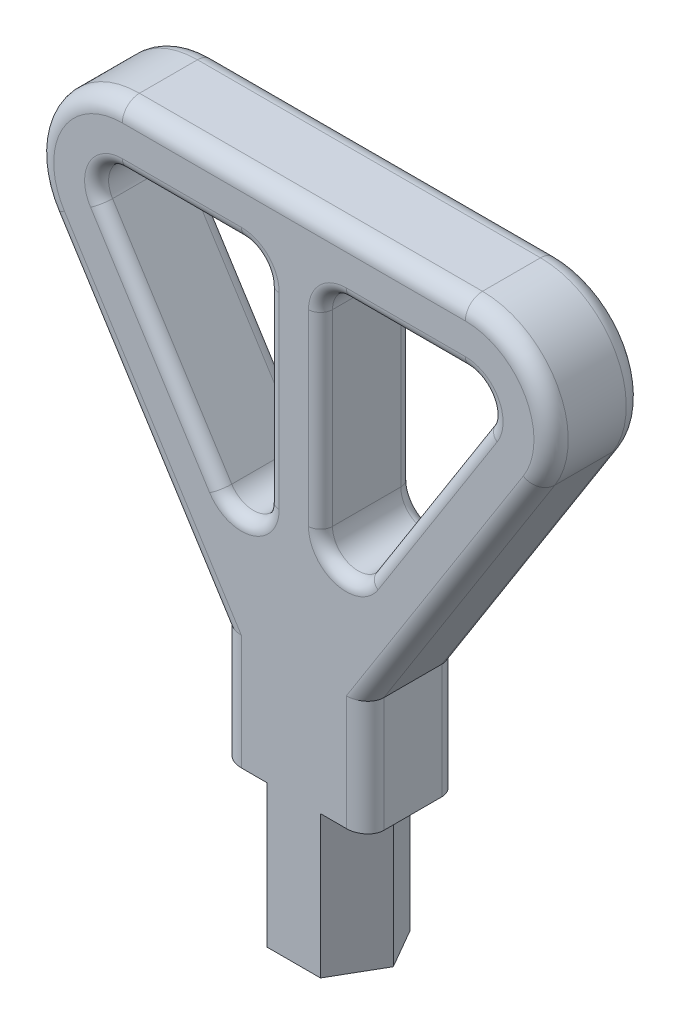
SolidWorks part; units mm, degrees
ref_plane "Front Plane" through (0, 0, 0) normal (0, 0, 1) x (1, 0, 0)
ref_plane "Top Plane" through (0, 0, 0) normal (0, 1, 0) x (1, 0, 0)
ref_plane "Right Plane" through (0, 0, 0) normal (1, 0, 0) x (0, 0, -1)
sketch "Sketch1" plane through (0, 0, 0) normal (0, 1, 0) x (1, 0, 0)
  line L0 (0, -3.4175) -> (0, -3.6175) construction
  line L1 (-1.9731, -3.4175) -> (1.9731, -3.4175)
  line L2 (1.9731, -3.4175) -> (3.9462, 0)
  line L3 (3.9462, 0) -> (1.9731, 3.4175)
  line L4 (1.9731, 3.4175) -> (-1.9731, 3.4175)
  line L5 (-1.9731, 3.4175) -> (-3.9462, 0)
  line L6 (-3.9462, 0) -> (-1.9731, -3.4175)
  line L7 (-2.0886, -3.6175) -> (2.0886, -3.6175) construction
  line L8 (2.0886, -3.6175) -> (4.1771, 0) construction
  line L9 (4.1771, 0) -> (2.0886, 3.6175) construction
  line L10 (2.0886, 3.6175) -> (-2.0886, 3.6175) construction
  line L11 (-2.0886, 3.6175) -> (-4.1771, 0) construction
  line L12 (-4.1771, 0) -> (-2.0886, -3.6175) construction
  circle A0 centre (0, 0) radius 3.4175 construction
  circle A2 centre (0, 0) radius 3.6175 construction
  point P1 (0, -3.4175)
  point P11 (0, -3.6175)
  dimension "D1" = 0.2
  dimension "D3" = 7.235
extrude "Boss-Extrude1" add sketch "Sketch1" along normal blind 10.541
sketch "Sketch2" plane through (0, 10.541, 0) normal (0, 1, 0) x (1, 0, 0)
  line L0 (1.9731, 0) -> (-1.9731, 0) construction
  line L1 (1.9731, -3.4175) -> (-1.9731, -3.4175)
  line L2 (1.9731, 3.4175) -> (-1.9731, 3.4175)
  arc A0 (1.9731, -3.4175) -> (1.9731, 3.4175) centre (1.9731, 0) ccw
  arc A1 (-1.9731, 3.4175) -> (-1.9731, -3.4175) centre (-1.9731, 0) ccw
  point P2 (0, 0)
extrude "Boss-Extrude2" add sketch "Sketch2" along normal blind 14.859
sketch "Sketch3" plane through (0, 0, 0) normal (0, 0, 1) x (1, 0, 0)
  line L0 (12.7, 19.05) -> (-12.7, 19.05) construction
  line L1 (12.7, 12.7) -> (-12.7, 12.7)
  line L2 (12.7, 25.4) -> (-12.7, 25.4)
  line L3 (-1.9731, 25.4) -> (1.9731, 25.4) construction
  arc A0 (12.7, 12.7) -> (12.7, 25.4) centre (12.7, 19.05) ccw
  arc A1 (-12.7, 25.4) -> (-12.7, 12.7) centre (-12.7, 19.05) ccw
  point P2 (0, 19.05)
  point P13 (0, 25.4)
  dimension "D1" = 12.7
  dimension "D2" = 25.4
extrude "Boss-Extrude3" add sketch "Sketch3" along normal up to surface and the other way up to surface
chamfer "Chamfer2" distance 0.4 angle 35 2 edges at (1.9731, 5.2705, -3.4175) (-1.9731, 5.2705, -3.4175)
sketch "Sketch4" plane through (0, 0, 0) normal (0, -1, 0) x (1, 0, 0)
  line L8 (-1.5731, -3.4175) -> (1.5731, -3.4175)
  line L9 (1.5731, -3.4175) -> (2.2445, -2.9474)
  line L10 (2.2445, -2.9474) -> (3.9462, 0)
  line L11 (3.9462, 0) -> (1.9731, 3.4175)
  line L12 (1.9731, 3.4175) -> (-1.9731, 3.4175)
  line L13 (-1.9731, 3.4175) -> (-3.9462, 0)
  line L14 (-3.9462, 0) -> (-2.2445, -2.9474)
  line L15 (-2.2445, -2.9474) -> (-1.5731, -3.4175)
  line L16 (-1.5731, -3.4175) -> (1.5731, -3.4175)
  line L17 (1.5731, -3.4175) -> (2.2445, -2.9474)
  line L18 (2.2445, -2.9474) -> (3.9462, 0)
  line L19 (3.9462, 0) -> (1.9731, 3.4175)
  line L20 (1.9731, 3.4175) -> (-1.9731, 3.4175)
  line L21 (-1.9731, 3.4175) -> (-3.9462, 0)
  line L22 (-3.9462, 0) -> (-2.2445, -2.9474)
  line L23 (-2.2445, -2.9474) -> (-1.5731, -3.4175)
  dimension "D1" = 0
extrude "Boss-Extrude4" add sketch "Sketch4" along normal blind 14.859
sketch "Sketch5" plane through (0, 10.541, 0) normal (0, -1, 0) x (1, 0, 0)
  line L0 (-1.9731, 3.4175) -> (1.9731, 3.4175)
  line L1 (-1.9731, -3.4175) -> (1.9731, -3.4175)
  arc A0 (-1.9731, 3.4175) -> (-1.9731, -3.4175) centre (-1.9731, 0) ccw construction
  arc A1 (1.9731, -3.4175) -> (1.9731, 3.4175) centre (1.9731, 0) ccw construction
  arc A2 (-1.9731, 3.4175) -> (-1.9731, -3.4175) centre (-1.9731, 0) ccw
  arc A3 (1.9731, -3.4175) -> (1.9731, 3.4175) centre (1.9731, 0) ccw
extrude "Boss-Extrude5" add sketch "Sketch5" along normal offset from surface (14.859 mm away) 10.541
sketch "Sketch6" plane through (0, 0, 3.4175) normal (0, 0, 1) x (1, 0, 0)
  line L0 (-5.3906, -4.318) -> (5.3906, -4.318)
  line L1 (5.3906, -4.318) -> (18.0614, 15.6474)
  line L2 (-5.3906, -4.318) -> (-18.0614, 15.6474)
  line L3 (-18.0614, 15.6474) -> (18.0614, 15.6474)
  arc A0 (12.7, 12.7) -> (12.7, 25.4) centre (12.7, 19.05) ccw construction
  arc A1 (-12.7, 25.4) -> (-12.7, 12.7) centre (-12.7, 19.05) ccw construction
extrude "Boss-Extrude7" add sketch "Sketch6" against normal up to surface (6.835 mm away)
fillet "Fillet1" radius 1.27 10 edges at (-11.726, 5.6647, -3.4175) (-18.2646, 22.1091, -3.4175) (-18.2646, 22.1091, 3.4175) (0, 25.4, -3.4175) (18.2646, 22.1091, 3.4175) (18.2646, 22.1091, -3.4175) (-11.726, 5.6647, 3.4175) (0, 25.4, 3.4175) (11.726, 5.6647, -3.4175) (11.726, 5.6647, 3.4175)
sketch "Sketch7" plane through (0, 0, 3.4175) normal (0, 0, 1) x (1, 0, 0)
  line L0 (-1.9731, -4.318) -> (-1.9731, -1.4075) construction
  line L2 (-1.9731, 5.1493) -> (-1.9731, 19.05)
  line L3 (3.9462, -4.318) -> (3.9462, -14.859) construction
  line L7 (0, 0) -> (0, 25.4) construction
  line L8 (-12.7, 25.4) -> (12.7, 25.4) construction
  line L9 (-3.8781, 20.955) -> (-12.7, 20.955)
  line L11 (-14.3084, 18.0292) -> (-5.4865, 4.1286)
  line L15 (-16.9891, 16.3279) -> (-3.8864, -4.318) construction
  line L16 (14.3084, 18.0292) -> (5.4865, 4.1286)
  line L17 (3.8781, 20.955) -> (12.7, 20.955)
  line L18 (1.9731, 5.1493) -> (1.9731, 19.05)
  arc A7 (-5.4865, 4.1286) -> (-1.9731, 5.1493) centre (-3.8781, 5.1493) ccw
  arc A8 (-1.9731, 19.05) -> (-3.8781, 20.955) centre (-3.8781, 19.05) ccw
  arc A9 (-12.7, 20.955) -> (-14.3084, 18.0292) centre (-12.7, 19.05) ccw
  arc A10 (-12.7, 24.13) -> (-16.9891, 16.3279) centre (-12.7, 19.05) ccw construction
  arc A11 (12.7, 20.955) -> (14.3084, 18.0292) centre (12.7, 19.05) cw
  arc A12 (5.4865, 4.1286) -> (1.9731, 5.1493) centre (3.8781, 5.1493) cw
  arc A13 (1.9731, 19.05) -> (3.8781, 20.955) centre (3.8781, 19.05) cw
  dimension "D1" = 1.905
extrude "Cut-Extrude1" cut sketch "Sketch7" against normal through all both and the other way through all
fillet "Fillet2" radius 0.889 24 edges at (3.3466, 3.32, -3.4175) (1.9731, 12.0997, -3.4175) (2.5311, 20.397, -3.4175) (8.289, 20.955, -3.4175) (14.3694, 19.9677, -3.4175) (-14.3694, 19.9677, -3.4175) (-8.289, 20.955, -3.4175) (-2.5311, 20.397, -3.4175) (-1.9731, 12.0997, -3.4175) (-3.3466, 3.32, -3.4175) (2.5311, 20.397, 3.4175) (8.289, 20.955, 3.4175) (14.3694, 19.9677, 3.4175) (9.8975, 11.0789, 3.4175) (3.3466, 3.32, 3.4175) (-14.3694, 19.9677, 3.4175) (-8.289, 20.955, 3.4175) (-2.5311, 20.397, 3.4175) (-1.9731, 12.0997, 3.4175) (-3.3466, 3.32, 3.4175) (9.8975, 11.0789, -3.4175) (-9.8975, 11.0789, -3.4175) (1.9731, 12.0997, 3.4175) (-9.8975, 11.0789, 3.4175)
sketch "Sketch8" plane through (0, -14.859, 0) normal (0, -1, 0) x (1, 0, 0)
  line L8 (-2.2445, -2.9474) -> (-1.5731, -3.4175)
  line L9 (-1.5731, -3.4175) -> (1.5731, -3.4175)
  line L10 (1.5731, -3.4175) -> (2.2445, -2.9474)
  line L11 (2.2445, -2.9474) -> (3.9462, 0)
  line L12 (3.9462, 0) -> (1.9731, 3.4175)
  line L13 (1.9731, 3.4175) -> (-1.9731, 3.4175)
  line L14 (-1.9731, 3.4175) -> (-3.9462, 0)
  line L15 (-3.9462, 0) -> (-2.2445, -2.9474)
  line L16 (-2.2445, -2.9474) -> (-1.5731, -3.4175)
  line L17 (-1.5731, -3.4175) -> (1.5731, -3.4175)
  line L18 (1.5731, -3.4175) -> (2.2445, -2.9474)
  line L19 (2.2445, -2.9474) -> (3.9462, 0)
  line L20 (3.9462, 0) -> (1.9731, 3.4175)
  line L21 (1.9731, 3.4175) -> (-1.9731, 3.4175)
  line L22 (-1.9731, 3.4175) -> (-3.9462, 0)
  line L23 (-3.9462, 0) -> (-2.2445, -2.9474)
  dimension "D1" = 0
extrude "Boss-Extrude8" add sketch "Sketch8" along normal blind 8.509
sketch "Sketch9" plane through (0, -4.318, 0) normal (0, -1, 0) x (1, 0, 0)
  line L0 (-5.3906, 2.1475) -> (-5.3906, -2.1475) construction
  line L1 (-3.8864, -3.4175) -> (-1.5731, -3.4175) construction
  line L2 (-1.5731, -3.4175) -> (-2.2445, -2.9474) construction
  line L3 (-2.2445, -2.9474) -> (-3.9462, 0) construction
  line L4 (-3.9462, 0) -> (-1.9731, 3.4175) construction
  line L5 (-1.9731, 3.4175) -> (-3.8864, 3.4175) construction
  line L6 (1.5731, -3.4175) -> (3.8864, -3.4175) construction
  line L7 (5.3906, -2.1475) -> (5.3906, 2.1475) construction
  line L8 (3.8864, 3.4175) -> (1.9731, 3.4175) construction
  line L9 (1.9731, 3.4175) -> (3.9462, 0) construction
  line L10 (3.9462, 0) -> (2.2445, -2.9474) construction
  line L11 (2.2445, -2.9474) -> (1.5731, -3.4175) construction
  line L12 (-5.3906, 2.1475) -> (-5.3906, -2.1475)
  line L13 (-3.8864, -3.4175) -> (-1.5731, -3.4175)
  line L14 (-1.5731, -3.4175) -> (-2.2445, -2.9474)
  line L15 (-2.2445, -2.9474) -> (-3.9462, 0)
  line L16 (-3.9462, 0) -> (-1.9731, 3.4175)
  line L17 (-1.9731, 3.4175) -> (-3.8864, 3.4175)
  line L18 (1.5731, -3.4175) -> (3.8864, -3.4175)
  line L19 (5.3906, -2.1475) -> (5.3906, 2.1475)
  line L20 (3.8864, 3.4175) -> (1.9731, 3.4175)
  line L21 (1.9731, 3.4175) -> (3.9462, 0)
  line L22 (3.9462, 0) -> (2.2445, -2.9474)
  line L23 (2.2445, -2.9474) -> (1.5731, -3.4175)
  ellipse E0 centre (-3.8864, -2.1475) end of major axis (-2.3823, -2.1475) minor radius 1.27 (-5.3906, -2.1475) -> (-3.8864, -3.4175) ccw construction
  ellipse E1 centre (-3.8864, 2.1475) end of major axis (-5.3906, 2.1475) minor radius 1.27 (-3.8864, 3.4175) -> (-5.3906, 2.1475) ccw construction
  ellipse E2 centre (3.8864, -2.1475) end of major axis (5.3906, -2.1475) minor radius 1.27 (3.8864, -3.4175) -> (5.3906, -2.1475) ccw construction
  ellipse E3 centre (3.8864, 2.1475) end of major axis (2.3823, 2.1475) minor radius 1.27 (5.3906, 2.1475) -> (3.8864, 3.4175) ccw construction
  ellipse E4 centre (-3.8864, -2.1475) end of major axis (-2.3823, -2.1475) minor radius 1.27 (-5.3906, -2.1475) -> (-3.8864, -3.4175) ccw
  ellipse E5 centre (-3.8864, 2.1475) end of major axis (-5.3906, 2.1475) minor radius 1.27 (-3.8864, 3.4175) -> (-5.3906, 2.1475) ccw
  ellipse E6 centre (3.8864, -2.1475) end of major axis (5.3906, -2.1475) minor radius 1.27 (3.8864, -3.4175) -> (5.3906, -2.1475) ccw
  ellipse E7 centre (3.8864, 2.1475) end of major axis (2.3823, 2.1475) minor radius 1.27 (5.3906, 2.1475) -> (3.8864, 3.4175) ccw
extrude "Boss-Extrude9" add sketch "Sketch9" along normal blind 8.509
